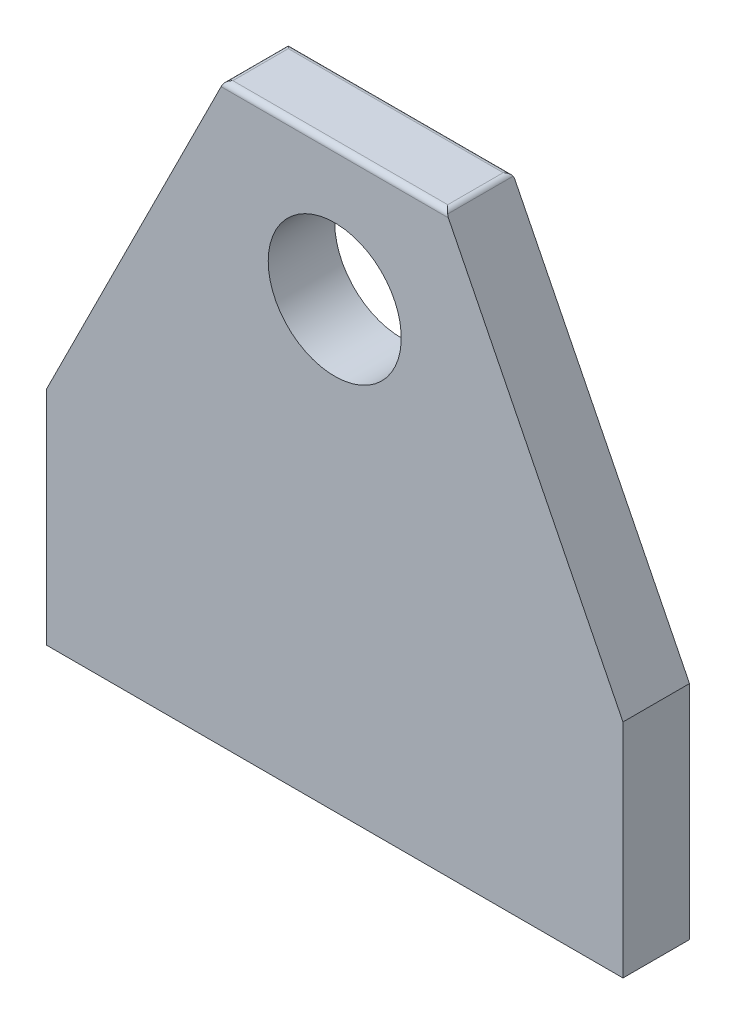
SolidWorks part; units mm, degrees
ref_plane "Front" through (0, 0, 0) normal (0, 0, 1) x (1, 0, 0)
ref_plane "Top" through (0, 0, 0) normal (0, 1, 0) x (1, 0, 0)
ref_plane "Right" through (0, 0, 0) normal (1, 0, 0) x (0, 0, -1)
sketch "Sketch1" plane through (0, 0, 0) normal (0, 0, 1) x (1, 0, 0)
  line L0 (0, 0) -> (0, 74.0054) construction
  line L1 (-15.875, 82.55) -> (15.875, 82.55)
  line L2 (15.875, 82.55) -> (41.275, 31.75)
  line L3 (-15.875, 82.55) -> (-41.275, 31.75)
  line L4 (41.275, 31.75) -> (41.275, 0)
  line L5 (-41.275, 31.75) -> (-41.275, 0)
  line L6 (41.275, 0) -> (-41.275, 0)
  line L7 (0, 0) -> (99.2345, 0) construction
  circle A0 centre (0, 63.5) radius 9.525
  dimension "D6" = 19.05
  dimension "D1" = 82.55
  dimension "D2" = 82.55
  dimension "D3" = 50.8
  dimension "D4" = 25.4
  dimension "D5" = 63.5
extrude "Base-Extrude" add sketch "Sketch1" along normal blind 9.525
fillet "Fillet1" radius 0.7937 4 edges at (15.875, 82.55, 4.7625) (0, 82.55, 9.525) (-15.875, 82.55, 4.7625) (0, 82.55, 0)
